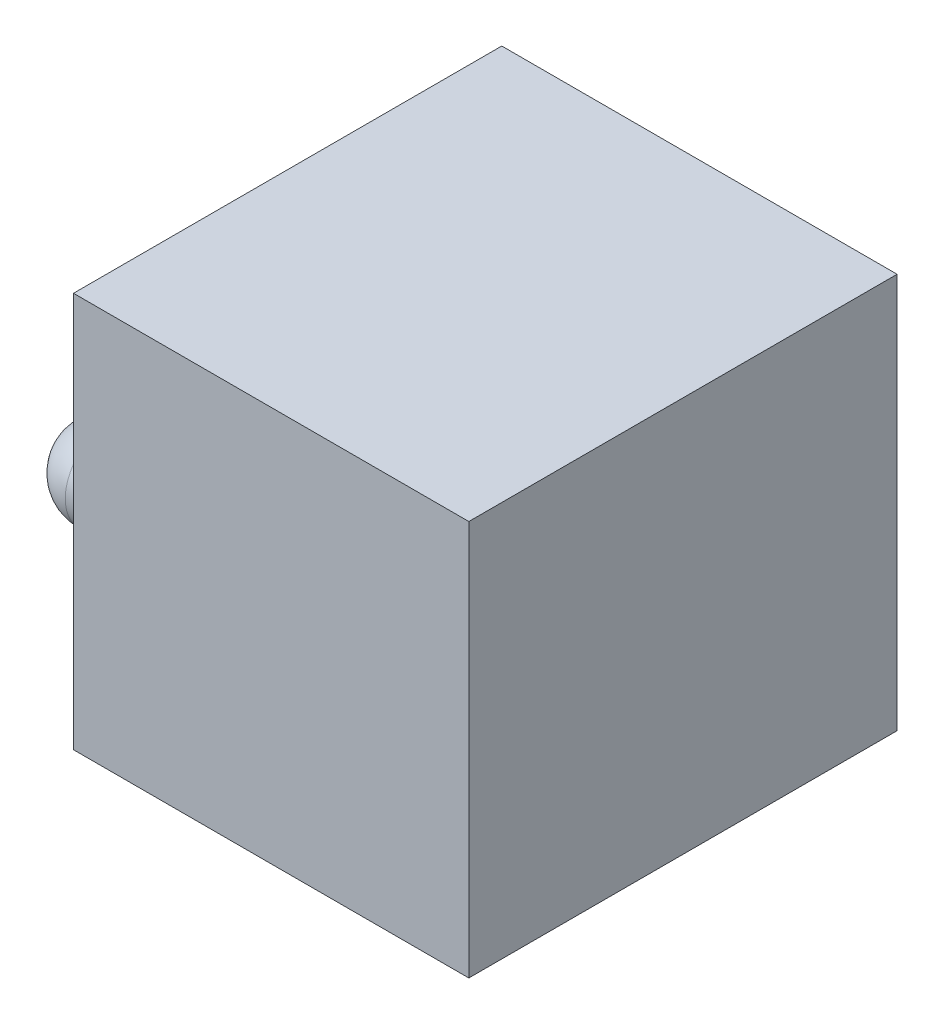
SolidWorks part; units mm, degrees
ref_plane "Front Plane" through (0, 0, 0) normal (0, 0, 1) x (1, 0, 0)
ref_plane "Top Plane" through (0, 0, 0) normal (0, 1, 0) x (1, 0, 0)
ref_plane "Right Plane" through (0, 0, 0) normal (1, 0, 0) x (0, 0, -1)
sketch "Sketch1" plane through (0, 0, 0) normal (0, 1, 0) x (1, 0, 0)
  line L1 (-12, -13) -> (12, -13)
  line L2 (-12, -13) -> (-12, 13)
  line L3 (-12, 13) -> (12, 13)
  line L4 (12, -13) -> (12, 13)
  line L5 (-12, -13) -> (12, 13) construction
  line L6 (-12, 13) -> (12, -13) construction
  point P0 (0, 0)
extrude "Boss-Extrude1" add sketch "Sketch1" along normal blind 24
sketch "Sketch2" plane through (-12, 0, 0) normal (-1, 0, 0) x (0, 0, 1)
  circle A0 centre (-4.5, 7.1489) radius 2.7
extrude "Boss-Extrude2" add sketch "Sketch2" along normal blind 9
fillet "Fillet2" radius 2.7 1 edges at (-21, 7.1489, -1.8)
mirror "Mirror2" about plane through (0, 0, 0) normal (0, 0, 1) of "Fillet2", "Boss-Extrude2"
equation "\"rail width\"= 24"
equation "\"system width\"= 125"
equation "\"system depth\"= 250"
equation "\"internal height\"= 100"
equation "\"carriage height\"= 24"
equation "\"belt width\"= 6"
equation "\"worm gear diameter\"= 8"
equation "\"D1@Sketch1\"=\"rail width\"+2"
equation "\"D2@Sketch1\"=\"rail width\""
equation "\"D1@Boss-Extrude1\"=\"carriage height\""
equation "\"pin spacing\"= 9"
equation "\"pin radius\"= 2.7"
equation "\"D1@Sketch2\"=\"pin radius\"*2"
equation "\"D2@Sketch2\"=\"pin spacing\"/2"
equation "\"D1@Boss-Extrude2\"=\"pin spacing\""
equation "\"D1@Fillet2\"=\"pin radius\""
